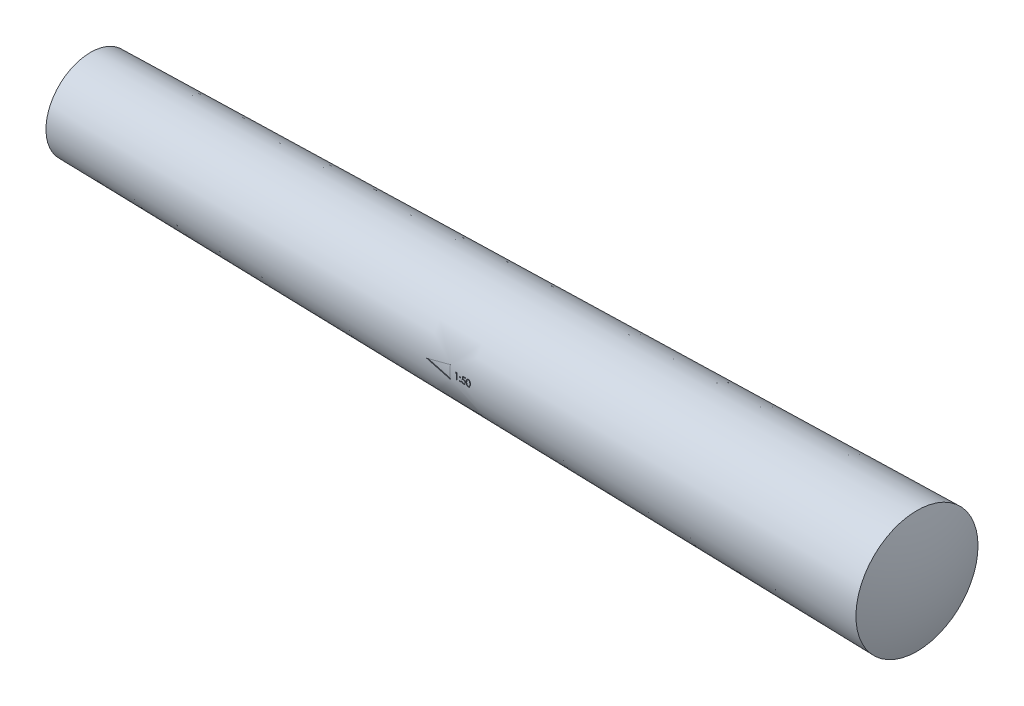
SolidWorks part; units mm, degrees
ref_plane "Front Plane" through (0, 0, 0) normal (0, 0, 1) x (1, 0, 0)
ref_plane "Top Plane" through (0, 0, 0) normal (0, 1, 0) x (1, 0, 0)
ref_plane "Right Plane" through (0, 0, 0) normal (1, 0, 0) x (0, 0, -1)
sketch "Sketch1" plane through (0, 0, 0) normal (1, 0, 0) x (0, 0, -1)
  circle A0 centre (0, 0) radius 7
  dimension "D1" = 14
extrude "Extrude1" add sketch "Sketch1" along normal mid plane 130
draft "Draft1" type of draft neutral plane draft angle 1.146 faces to draft 1 parameters "D1"=1.146
sketch "Sketch2" plane through (0, 0, 0) normal (0, 0, 1) x (1, 0, 0)
  line L0 (-65, 0) -> (-65, 7)
  line L1 (-65, 7) -> (-65, -7) construction
  line L2 (-65, 0) -> (-66.6, 0)
  line L3 (-66.6, 0) -> (-66.6, -8.3) construction
  line L4 (65, 0) -> (65, 9.6001)
  line L5 (65, -9.6001) -> (65, 9.6001) construction
  line L6 (65, 0) -> (66.6, 0)
  line L7 (66.6, 0) -> (66.6, -8.3) construction
  line L8 (-65, -7) -> (65, -9.6001) construction
  arc A0 (-66.6, 0) -> (-65, 7) centre (-50.4875, 0) cw
  arc A1 (66.6, 0) -> (65, 9.6001) centre (36.9995, 0) ccw
  point P14 (0, -8.3)
revolve "Revolve1" add sketch "Sketch2" angle 360 about L2
sketch "Sketch5" plane through (0, 0, 0) normal (0, 0, 1) x (1, 0, 0)
  line L0 (0, 8.3) -> (0, -8.3) construction
  line L1 (65, 9.6001) -> (-65, 7) construction
  line L2 (-65, -7) -> (65, -9.6001) construction
ref_plane "Plane2" through (0, 0, 0) normal (-0.02, 0, 0.9998) x (0.9998, 0, 0.02)
sketch "Sketch6" plane through (0, 0, 0) normal (-0.02, 0, 0.9998) x (0.9998, 0, 0.02)
  line L0 (0, 0) -> (0, 1)
  line L1 (0, 8.3) -> (0, -8.3) construction
  line L2 (0, 1) -> (-3.7321, 0)
  line L3 (-3.7321, 0) -> (0, -1)
  line L4 (0, -1) -> (0, 0)
  line L5 (0, -0.5) -> (4, -0.5) construction
  text T0 "1:50" font "Century Gothic" height 1
  dimension "D1" = 2
  dimension "D2" = 30
  dimension "D3" = 4
wrap "Wrap2" sketch "Sketch6" wrap type deboss source sketch "Sketch6" thickness 0.1 parameters "D1"=0.1
equation "\"D2@Sketch2\" = \"D1@Sketch2\""
